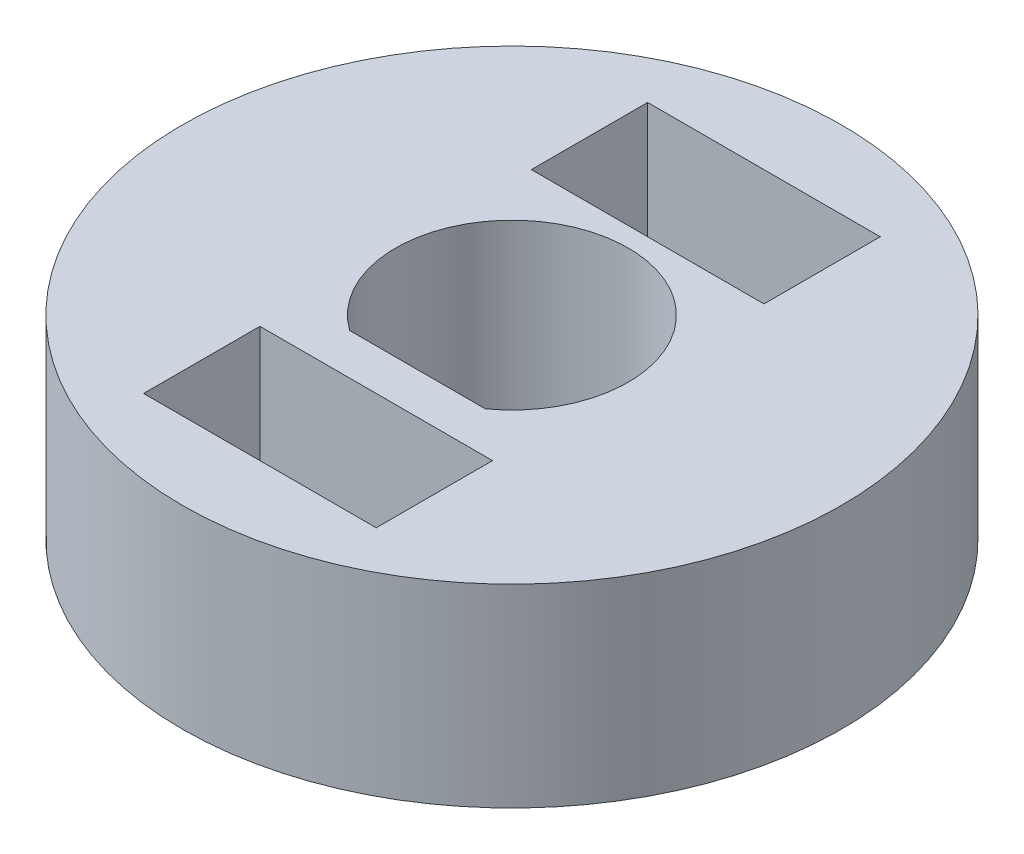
SolidWorks part; units mm, degrees
ref_plane "Front" through (0, 0, 0) normal (0, 0, 1) x (1, 0, 0)
ref_plane "Top" through (0, 0, 0) normal (0, 1, 0) x (1, 0, 0)
ref_plane "Right" through (0, 0, 0) normal (1, 0, 0) x (0, 0, -1)
sketch "草图1" plane through (0, 0, 0) normal (0, 1, 0) x (1, 0, 0)
  line L0 (-1.75, -2.4367) -> (1.75, -2.4367)
  circle A0 centre (0, 0) radius 8.5
  arc A1 (1.75, -2.4367) -> (-1.75, -2.4367) centre (0, 0) ccw
  point P6 (0, -2.4367)
  dimension "D1" = 17
  dimension "D2" = 6
  dimension "D3" = 3.5
extrude "凸台-拉伸1" add sketch "草图1" along normal blind 5
sketch "草图2" plane through (0, 5, 0) normal (0, 1, 0) x (1, 0, 0)
  line L1 (-3, -3.5) -> (3, -3.5)
  line L14 (-3, -3.5) -> (-3, -6.5)
  line L15 (-3, -6.5) -> (3, -6.5)
  line L16 (3, -6.5) -> (3, -3.5)
  line L17 (-3, 3.5) -> (3, 3.5)
  line L18 (3, 3.5) -> (3, 6.5)
  line L19 (3, 6.5) -> (-3, 6.5)
  line L20 (-3, 6.5) -> (-3, 3.5)
  circle A0 centre (0, 0) radius 3 construction
  point P6 (0, -3.5)
  point P13 (0, 3.5)
  dimension "D1" = 3.5
  dimension "D2" = 6
  dimension "D4" = 6
  dimension "D5" = 3
  dimension "D6" = 3
  dimension "D7" = 3.5
extrude "切除-拉伸1" cut sketch "草图2" against normal blind 5
